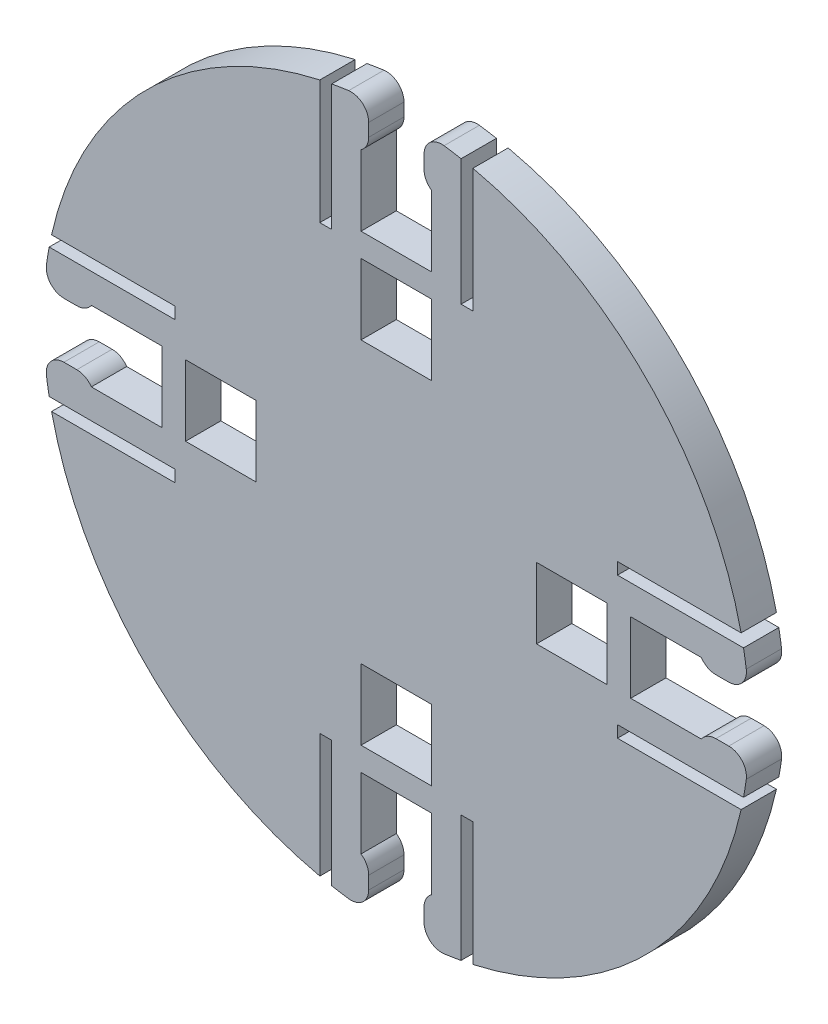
SolidWorks part; units mm, degrees
ref_plane "Front Plane" through (0, 0, 0) normal (0, 0, 1) x (1, 0, 0)
ref_plane "Top Plane" through (0, 0, 0) normal (0, 1, 0) x (1, 0, 0)
ref_plane "Right Plane" through (0, 0, 0) normal (1, 0, 0) x (0, 0, -1)
sketch "Sketch1" plane through (0, 0, 0) normal (0, 0, 1) x (1, 0, 0)
  line L0 (0, -1000) -> (0, 49000) construction
  line L1 (-1000, 0) -> (49000, 0) construction
  line L2 (2.35, 25.9078) -> (3, 25.9078)
  line L3 (-3, 17.9078) -> (3, 17.9078)
  line L4 (-3, 17.9078) -> (-3, 11.9078)
  line L5 (-3, 11.9078) -> (3, 11.9078)
  line L6 (3, 17.9078) -> (3, 11.9078)
  line L7 (-3, 25.9078) -> (-2.35, 25.9078)
  line L8 (-3, 25.9078) -> (-3, 19.9078)
  line L9 (-3, 19.9078) -> (3, 19.9078)
  line L10 (3, 25.9078) -> (3, 19.9078)
  line L11 (-2.35, 29.9078) -> (-2.35, 25.9078)
  line L12 (2.35, 29.9078) -> (2.35, 25.9078)
  line L13 (-5.5, 29.4915) -> (-5.5, 18.7874)
  line L14 (-5.5, 18.7874) -> (-6.5, 18.7874)
  line L15 (-6.5, 18.7874) -> (-6.5, 29.2874)
  line L16 (5.5, 18.7874) -> (6.5, 18.7874)
  line L17 (5.5, 29.4915) -> (5.5, 18.7874)
  line L18 (6.5, 18.7874) -> (6.5, 29.2874)
  line L19 (18.7874, 6.5) -> (29.2874, 6.5)
  line L20 (18.7874, 5.5) -> (18.7874, 6.5)
  line L21 (29.4915, 5.5) -> (18.7874, 5.5)
  line L22 (29.9078, 2.35) -> (25.9078, 2.35)
  line L23 (29.9078, -2.35) -> (25.9078, -2.35)
  line L24 (25.9078, 3) -> (25.9078, 2.35)
  line L25 (25.9078, 3) -> (19.9078, 3)
  line L26 (19.9078, 3) -> (19.9078, -3)
  line L27 (25.9078, -3) -> (19.9078, -3)
  line L28 (25.9078, -2.35) -> (25.9078, -3)
  line L29 (29.4915, -5.5) -> (18.7874, -5.5)
  line L30 (18.7874, -6.5) -> (29.2874, -6.5)
  line L31 (18.7874, -5.5) -> (18.7874, -6.5)
  line L32 (17.9078, -3) -> (11.9078, -3)
  line L33 (17.9078, 3) -> (17.9078, -3)
  line L34 (17.9078, 3) -> (11.9078, 3)
  line L35 (11.9078, 3) -> (11.9078, -3)
  line L36 (6.5, -18.7874) -> (6.5, -29.2874)
  line L37 (5.5, -18.7874) -> (6.5, -18.7874)
  line L38 (5.5, -29.4915) -> (5.5, -18.7874)
  line L39 (2.35, -29.9078) -> (2.35, -25.9078)
  line L40 (-2.35, -29.9078) -> (-2.35, -25.9078)
  line L41 (3, -25.9078) -> (2.35, -25.9078)
  line L42 (3, -25.9078) -> (3, -19.9078)
  line L43 (3, -19.9078) -> (-3, -19.9078)
  line L44 (-3, -25.9078) -> (-3, -19.9078)
  line L45 (-2.35, -25.9078) -> (-3, -25.9078)
  line L46 (-5.5, -29.4915) -> (-5.5, -18.7874)
  line L47 (-6.5, -18.7874) -> (-6.5, -29.2874)
  line L48 (-5.5, -18.7874) -> (-6.5, -18.7874)
  line L49 (-3, -17.9078) -> (-3, -11.9078)
  line L50 (3, -17.9078) -> (-3, -17.9078)
  line L51 (3, -17.9078) -> (3, -11.9078)
  line L52 (3, -11.9078) -> (-3, -11.9078)
  line L53 (-18.7874, -6.5) -> (-29.2874, -6.5)
  line L54 (-18.7874, -5.5) -> (-18.7874, -6.5)
  line L55 (-29.4915, -5.5) -> (-18.7874, -5.5)
  line L56 (-29.9078, -2.35) -> (-25.9078, -2.35)
  line L57 (-29.9078, 2.35) -> (-25.9078, 2.35)
  line L58 (-25.9078, -3) -> (-25.9078, -2.35)
  line L59 (-25.9078, -3) -> (-19.9078, -3)
  line L60 (-19.9078, -3) -> (-19.9078, 3)
  line L61 (-25.9078, 3) -> (-19.9078, 3)
  line L62 (-25.9078, 2.35) -> (-25.9078, 3)
  line L63 (-29.4915, 5.5) -> (-18.7874, 5.5)
  line L64 (-18.7874, 6.5) -> (-29.2874, 6.5)
  line L65 (-18.7874, 5.5) -> (-18.7874, 6.5)
  line L66 (-17.9078, 3) -> (-11.9078, 3)
  line L67 (-17.9078, -3) -> (-17.9078, 3)
  line L68 (-17.9078, -3) -> (-11.9078, -3)
  line L69 (-11.9078, -3) -> (-11.9078, 3)
  arc A0 (-2.35, 29.9078) -> (-5.5, 29.4915) centre (0, 0) ccw
  arc A1 (-6.5, 29.2874) -> (-29.2874, 6.5) centre (0, 0) ccw
  arc A2 (5.5, 29.4915) -> (2.35, 29.9078) centre (0, 0) ccw
  arc A3 (-29.4915, 5.5) -> (-29.9078, 2.35) centre (0, 0) ccw
  arc A4 (-30, 0) -> (-29.4915, -5.5) centre (0, 0) ccw
  arc A5 (-29.2874, -6.5) -> (-6.5, -29.2874) centre (0, 0) ccw
  arc A6 (-5.5, -29.4915) -> (-2.35, -29.9078) centre (0, 0) ccw
  arc A7 (2.35, -29.9078) -> (5.5, -29.4915) centre (0, 0) ccw
  arc A8 (6.5, -29.2874) -> (29.2874, -6.5) centre (0, 0) ccw
  arc A9 (29.2874, 6.5) -> (6.5, 29.2874) centre (0, 0) ccw
  arc A10 (29.9078, 2.35) -> (29.4915, 5.5) centre (0, 0) ccw
  arc A11 (29.4915, -5.5) -> (29.9078, -2.35) centre (0, 0) ccw
  point P89 (0, 0)
extrude "Boss-Extrude1" add sketch "Sketch1" along normal blind 3 contours L29 A11 L23 L28 L27 L26 L25 L24 L22 A10 L21 L20 L19 A9 L18 L16 L17 A2 L12 L2 L10 L9 L8 L7 L11 A0 L13 L14 L15 A1 L64 L65 L63 A3 L57 L62 L61 L60 L59 L58 L56 A4 L55 L54 L53 A5 L47 L48 L46 A6 L40
fillet "Fillet1" radius 1.5 16 edges at (25.9078, 2.35, 1.5) (25.9078, -2.35, 1.5) (29.9078, -2.35, 1.5) (29.9078, 2.35, 1.5) (-2.35, -29.9078, 1.5) (2.35, -29.9078, 1.5) (-2.35, -25.9078, 1.5) (2.35, -25.9078, 1.5) (-25.9078, -2.35, 1.5) (-25.9078, 2.35, 1.5) (-29.9078, -2.35, 1.5) (-29.9078, 2.35, 1.5) (2.35, 25.9078, 1.5) (-2.35, 25.9078, 1.5) (-2.35, 29.9078, 1.5) (2.35, 29.9078, 1.5)
equation "\"D6@Sketch1\"=\"D2@Sketch1\"+\"D4@Sketch1\"+0.5mm"
equation "\"D4@Sketch1\"=\"D10@Sketch1\""
